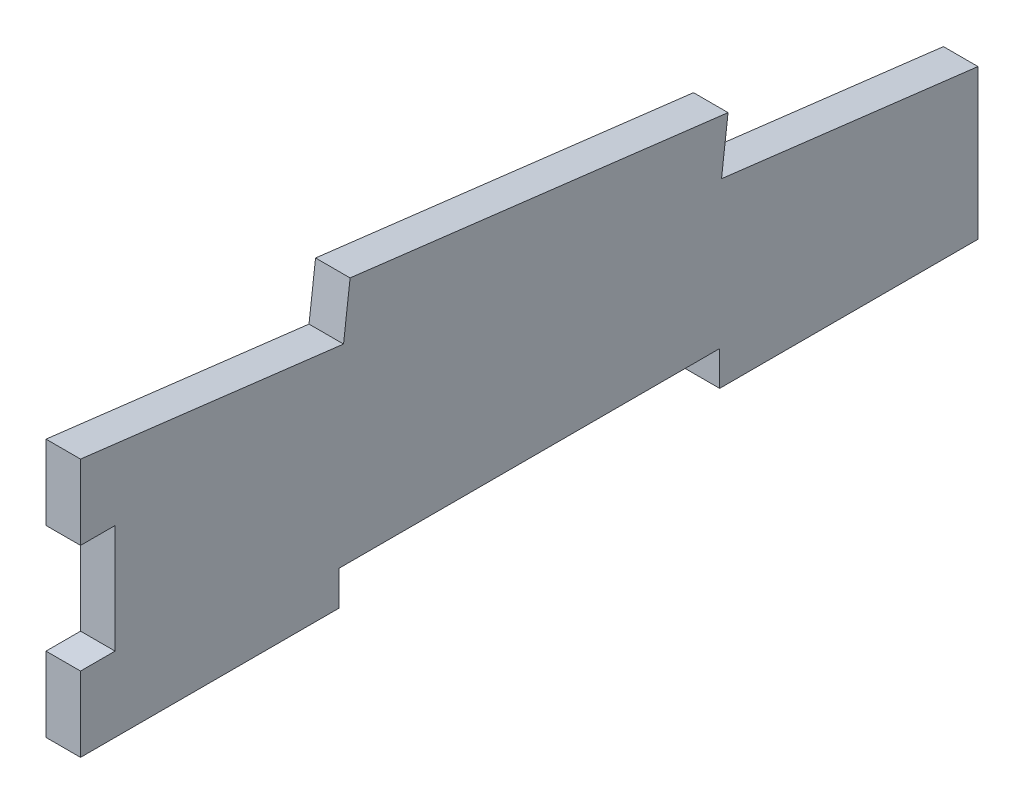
SolidWorks part; units mm, degrees
ref_plane "Front Plane" through (0, 0, 0) normal (0, 0, 1) x (1, 0, 0)
ref_plane "Top Plane" through (0, 0, 0) normal (0, 1, 0) x (1, 0, 0)
ref_plane "Right Plane" through (0, 0, 0) normal (1, 0, 0) x (0, 0, -1)
sketch "Sketch1" plane through (0, 0, 0) normal (1, 0, 0) x (0, 0, -1)
  line L0 (-127.9138, -22.3333) -> (-127.9138, -36.0833)
  line L1 (-127.9138, -69.8333) -> (-80.4138, -69.8333)
  line L2 (37.0862, -69.8333) -> (37.0862, -42.3333)
  line L3 (37.0862, -42.3333) -> (-10.0687, -36.6176)
  line L5 (-79.56, -28.1944) -> (-78.3567, -18.2671)
  line L6 (-10.0687, -36.6176) -> (-8.8654, -26.6903)
  line L7 (-78.3567, -18.2671) -> (-8.8654, -26.6903)
  line L8 (-79.56, -28.1944) -> (-127.9138, -22.3333)
  line L9 (-10.4138, -69.8333) -> (37.0862, -69.8333)
  line L11 (-80.4138, -69.8333) -> (-80.4138, -63.4833)
  line L12 (-80.4138, -63.4833) -> (-10.4138, -63.4833)
  line L13 (-10.4138, -69.8333) -> (-10.4138, -63.4833)
  line L14 (-127.9138, -56.0833) -> (-127.9138, -69.8333)
  line L15 (-127.9138, -36.0833) -> (-121.5638, -36.0833)
  line L17 (-127.9138, -56.0833) -> (-121.5638, -56.0833)
  line L18 (-121.5638, -36.0833) -> (-121.5638, -56.0833)
  dimension "D1" = 165
  dimension "D2" = 47.5
  dimension "D3" = 27.5
  dimension "D4" = 37.5631
  dimension "D5" = 69.8333
  dimension "D6" = 10
  dimension "D7" = 70
  dimension "D8" = 47.5
  dimension "D9" = 48.7077
  dimension "D10" = 49.5571
  dimension "D11" = 45.9515
  dimension "D12" = 70
  dimension "D13" = 6.35
  dimension "D14" = 47.5
  dimension "D15" = 20
  dimension "D16" = 6.35
  dimension "D17" = 13.75
extrude "Boss-Extrude1" add sketch "Sketch1" along normal blind 6.35
